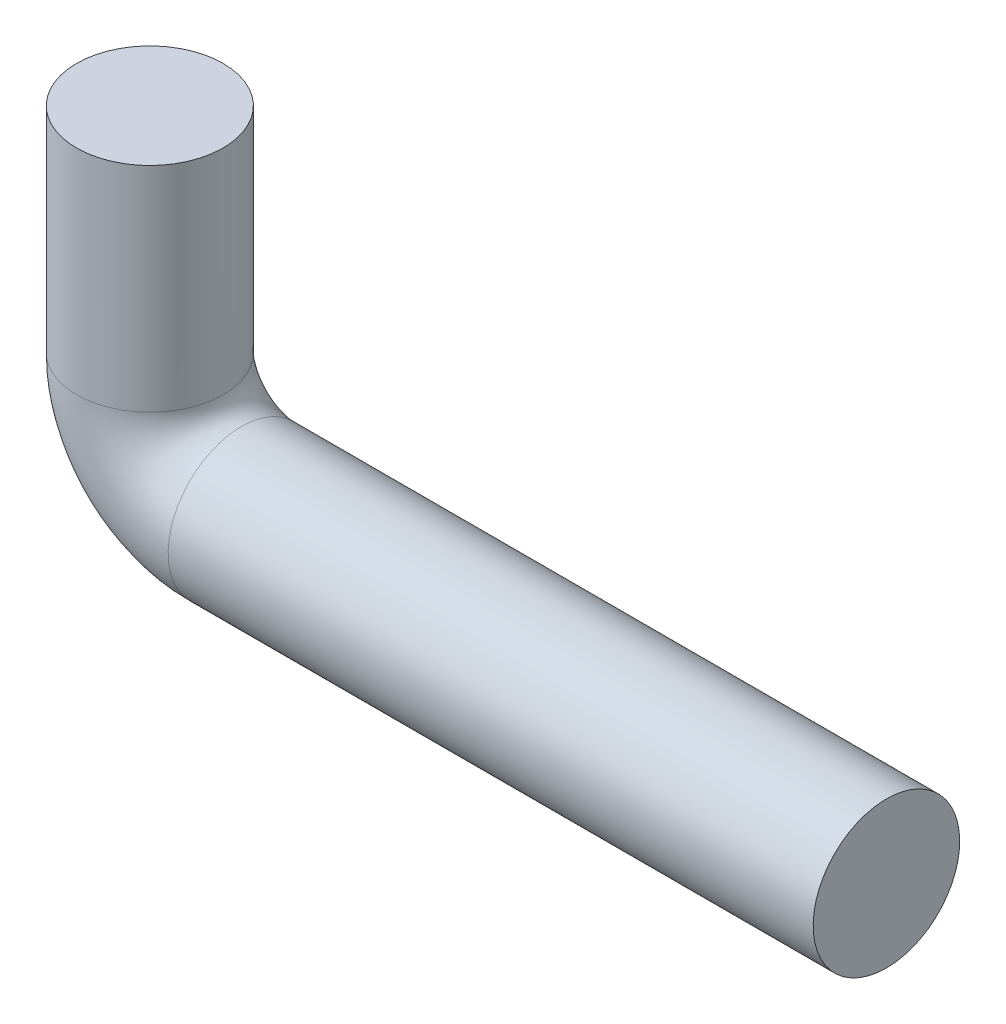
SolidWorks part; units mm, degrees
ref_plane "Front Plane" through (0, 0, 0) normal (0, 0, 1) x (1, 0, 0)
ref_plane "Top Plane" through (0, 0, 0) normal (0, 1, 0) x (1, 0, 0)
ref_plane "Right Plane" through (0, 0, 0) normal (1, 0, 0) x (0, 0, -1)
sketch "Sketch path front shaft" plane through (0, 0, 0) normal (0, 0, 1) x (1, 0, 0)
  line L0 (15, 0) -> (120.65, 0)
  line L1 (0, 15) -> (0, 50)
  arc A0 (15, 0) -> (0, 15) centre (15, 15) cw
  point P6 (0, 0)
  dimension "D1" = 15
  dimension "D2" = 35
  dimension "D3" = 105.65
sweep "front shaft" add path "Sketch path front shaft" parameters "D3"=24
